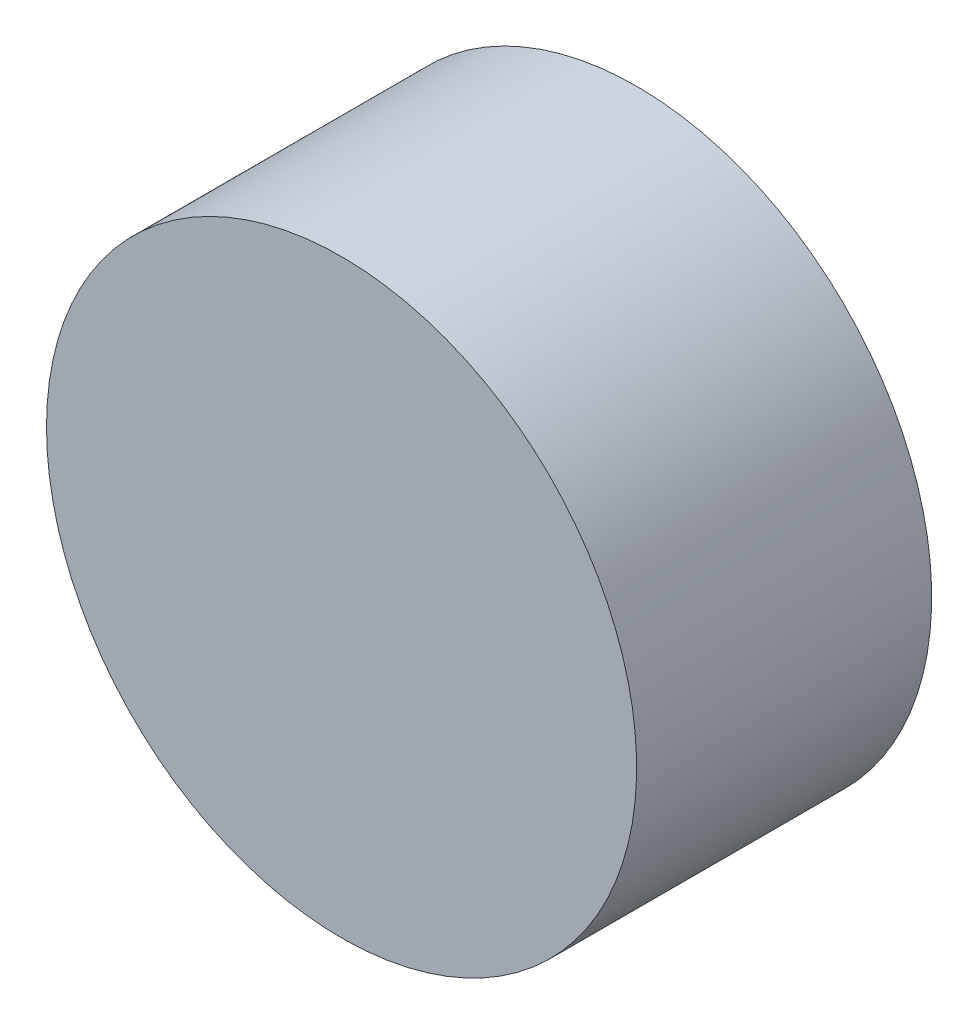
SolidWorks part; units mm, degrees
ref_plane "Face" through (0, 0, 0) normal (0, 0, 1) x (1, 0, 0)
ref_plane "Dessus" through (0, 0, 0) normal (0, 1, 0) x (1, 0, 0)
ref_plane "Droite" through (0, 0, 0) normal (1, 0, 0) x (0, 0, -1)
sketch "Esquisse1" plane through (0, 0, 0) normal (0, 0, 1) x (1, 0, 0)
  circle A0 centre (0, 0) radius 3
  dimension "D1" = 6
extrude "Extrusion1" add sketch "Esquisse1" along normal blind 3
